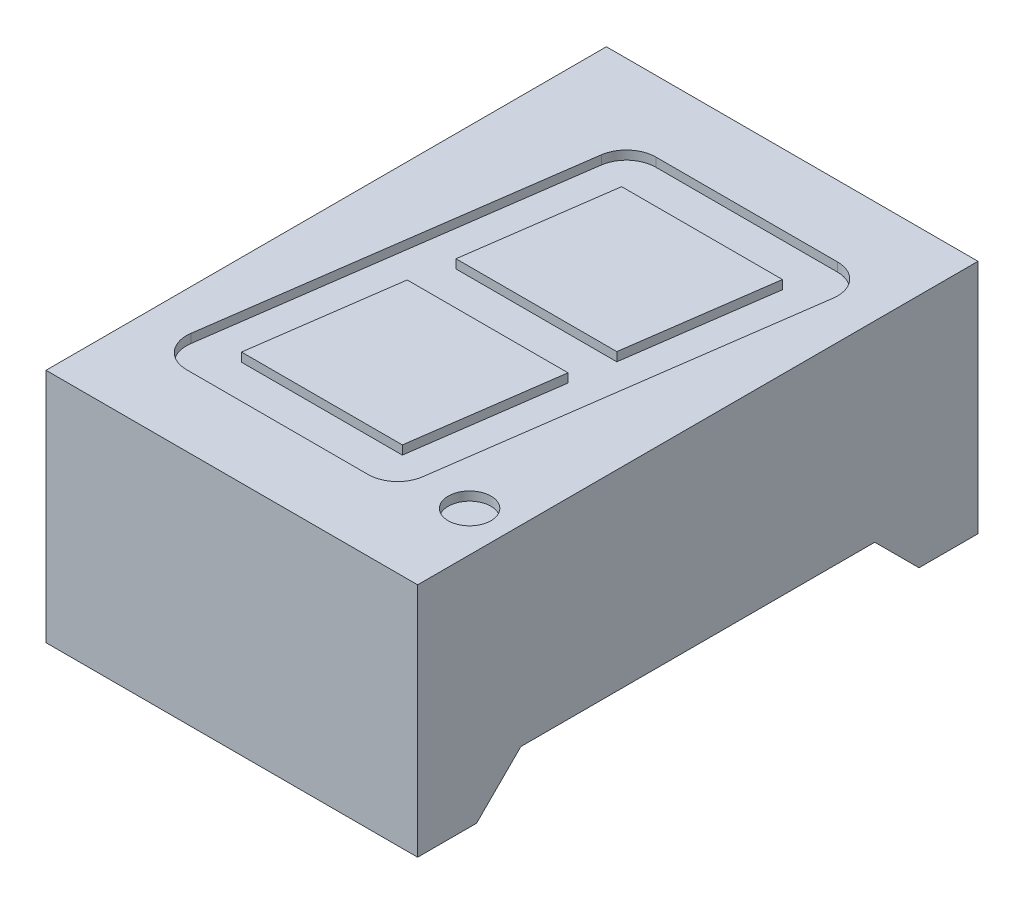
SolidWorks part; units mm, degrees
ref_plane "Front Plane" through (0, 0, 0) normal (0, 0, 1) x (1, 0, 0)
ref_plane "Top Plane" through (0, 0, 0) normal (0, 1, 0) x (1, 0, 0)
ref_plane "Right Plane" through (0, 0, 0) normal (1, 0, 0) x (0, 0, -1)
sketch "Sketch1" plane through (0, 0, 0) normal (0, 1, 0) x (1, 0, 0)
  line L1 (0, 0) -> (12.6, 0)
  line L2 (0, 0) -> (0, -19)
  line L3 (0, -19) -> (12.6, -19)
  line L4 (12.6, 0) -> (12.6, -19)
  dimension "D1" = 12.6
  dimension "D2" = 19
extrude "Boss-Extrude1" add sketch "Sketch1" along normal blind 8
sketch "Sketch2" plane through (0, 8, 0) normal (0, 1, 0) x (1, 0, 0)
  line L0 (1.3725, -15.4608) -> (3.0871, -3.2608)
  line L1 (4.0773, -2.4) -> (10.2373, -2.4)
  line L2 (11.2275, -3.5392) -> (9.5129, -15.7392)
  line L3 (8.5227, -16.6) -> (2.3627, -16.6)
  line L4 (3.6754, -8.775) -> (4.3675, -3.85)
  line L5 (4.3675, -3.85) -> (9.8206, -3.85)
  line L6 (9.8206, -3.85) -> (9.1284, -8.775)
  line L7 (9.1284, -8.775) -> (3.6754, -8.775)
  line L8 (9.1731, -8.4573) -> (10.5099, -8.6451) construction
  line L9 (2.7794, -15.15) -> (3.4716, -10.225)
  line L10 (3.4716, -10.225) -> (8.9246, -10.225)
  line L11 (8.9246, -10.225) -> (8.2325, -15.15)
  line L12 (8.2325, -15.15) -> (2.7794, -15.15)
  line L13 (3.7906, -7.955) -> (2.4537, -7.7672) construction
  line L14 (8.5342, -13.0033) -> (9.871, -13.1912) construction
  line L15 (3.2587, -11.7398) -> (1.9218, -11.5519) construction
  line L16 (6.1981, -10.225) -> (6.1981, -8.775) construction
  line L17 (6.323, -15.15) -> (6.323, -16.6) construction
  line L18 (7.4152, -3.85) -> (7.4152, -2.4) construction
  line L19 (0, -9.5) -> (2.2102, -9.5) construction
  line L20 (0, 0) -> (0, -19) construction
  line L21 (12.6, -9.5) -> (10.3898, -9.5) construction
  line L22 (12.6, -19) -> (12.6, 0) construction
  line L23 (6.3, -19) -> (6.3, -16.6) construction
  line L24 (0, -19) -> (12.6, -19) construction
  line L25 (6.3, 0) -> (6.3, -2.4) construction
  line L26 (12.6, 0) -> (0, 0) construction
  line L27 (11.2373, -15.875) -> (11.2373, -3.4) construction
  line L28 (6.323, -15.875) -> (7.673, -15.875) construction
  arc A0 (9.5129, -15.7392) -> (8.5227, -16.6) centre (8.5227, -15.6) cw
  arc A1 (1.3725, -15.4608) -> (2.3627, -16.6) centre (2.3627, -15.6) ccw
  arc A2 (10.2373, -2.4) -> (11.2275, -3.5392) centre (10.2373, -3.4) cw
  arc A3 (3.0871, -3.2608) -> (4.0773, -2.4) centre (4.0773, -3.4) cw
  circle A4 centre (11.2373, -15.875) radius 0.725
  point P30 (6.1981, -9.5)
  dimension "D6" = 1
  dimension "D7" = 1.45
  dimension "D1" = 82
  dimension "D2" = 1.45
  dimension "D3" = 8.1
  dimension "D4" = 14.2
  dimension "D5" = 1.35
extrude "Cut-Extrude1" cut sketch "Sketch2" against normal blind 0.3
sketch "Sketch3" plane through (0, 0, 0) normal (-1, 0, 0) x (0, 0, 1)
  line L0 (2, 0) -> (3.5, 1.5)
  line L1 (0, 0) -> (19, 0) construction
  line L2 (3.5, 1.5) -> (15.5, 1.5)
  line L3 (15.5, 1.5) -> (17, 0)
  line L4 (17, 0) -> (2, 0)
  line L5 (9.5, 1.5) -> (9.5, 4.3786) construction
  line L6 (0, 8) -> (0, 0) construction
  line L7 (19, 8) -> (19, 0) construction
  dimension "D1" = 15
  dimension "D2" = 1.5
  dimension "D3" = 45
extrude "Cut-Extrude2" cut sketch "Sketch3" against normal through all
